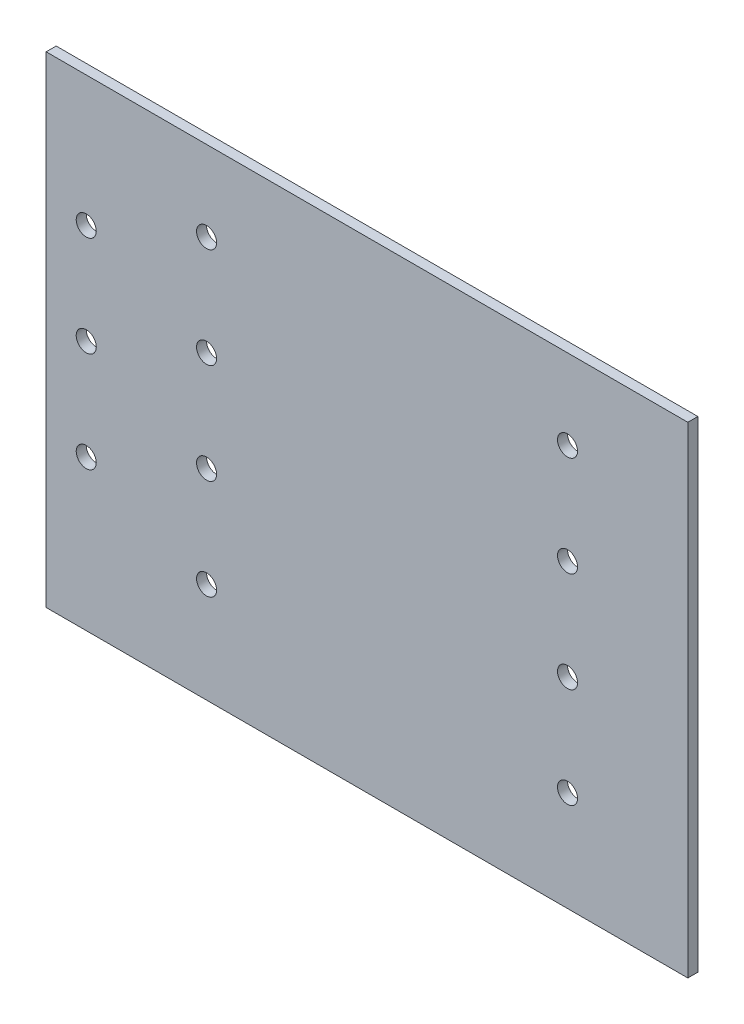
SolidWorks part; units mm, degrees
ref_plane "Front Plane" through (0, 0, 0) normal (0, 0, 1) x (1, 0, 0)
ref_plane "Top Plane" through (0, 0, 0) normal (0, 1, 0) x (1, 0, 0)
ref_plane "Right Plane" through (0, 0, 0) normal (1, 0, 0) x (0, 0, -1)
sketch "Sketch1" plane through (0, 0, 0) normal (1, 0, 0) x (0, 0, -1)
  line L1 (0, 0) -> (25.4, 0)
  line L2 (0, 0) -> (0, 1219.2)
  line L3 (0, 1219.2) -> (25.4, 1219.2)
  line L4 (25.4, 0) -> (25.4, 1219.2)
  dimension "D1" = 1219.2
  dimension "D2" = 25.4
extrude "Boss-Extrude1" add sketch "Sketch1" along normal blind 1625.6
sketch "Sketch2" plane through (0, 0, 0) normal (0, 0, 1) x (1, 0, 0)
  line L0 (1625.6, 1219.2) -> (1625.6, 0) construction
  line L1 (1625.6, 0) -> (0, 0) construction
  circle A0 centre (1320.8, 254) radius 25.4
  dimension "D1" = 50.8
  dimension "D3" = 254
  dimension "D2" = 304.8
extrude "Cut-Extrude1" cut sketch "Sketch2" against normal up to next
pattern_linear "LPattern1" count 2 spacing 914.4 along (-1, 0, 0) count 4 spacing 254 along (0, 1, 0) of "Cut-Extrude1"
sketch "Sketch3" plane through (0, 0, 0) normal (0, 0, 1) x (1, 0, 0)
  circle A0 centre (101.6, 381) radius 25.4
  circle A1 centre (406.4, 254) radius 25.4 construction
  dimension "D1" = 50.8
  dimension "D2" = 304.8
  dimension "D3" = 127
extrude "Cut-Extrude2" cut sketch "Sketch3" against normal up to next
pattern_linear "LPattern2" count 3 spacing 254 along (0, 1, 0) of "Cut-Extrude2"
